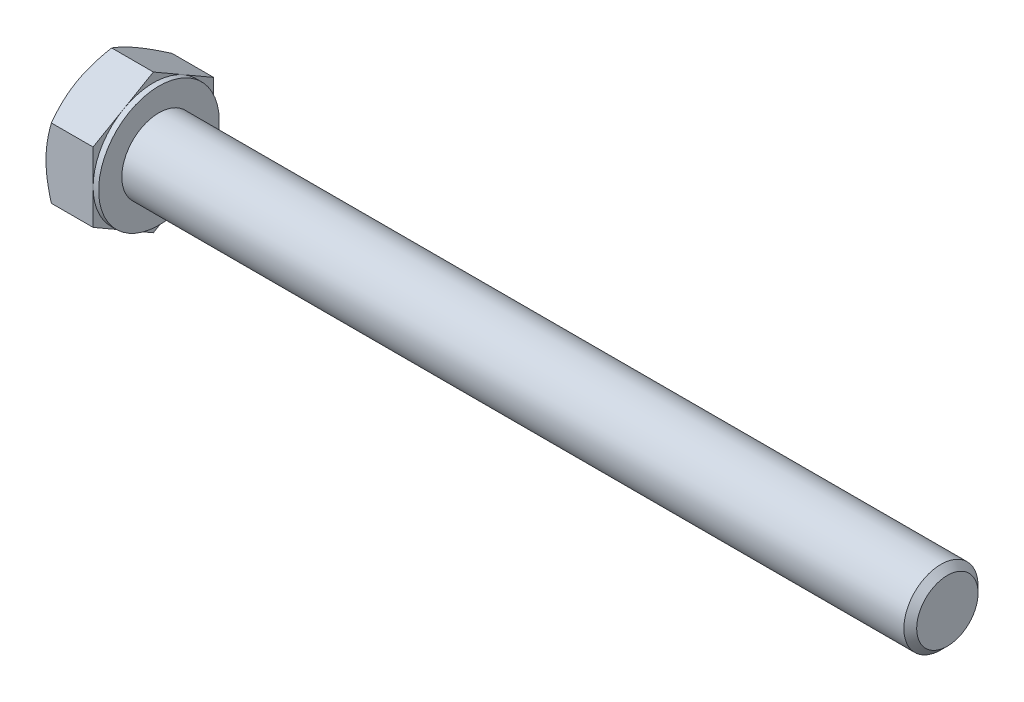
SolidWorks part; units mm, degrees
ref_plane "Plane1" through (0, 0, 0) normal (0, 0, 1) x (1, 0, 0)
ref_plane "Plane2" through (0, 0, 0) normal (0, 1, 0) x (1, 0, 0)
ref_plane "Plane3" through (0, 0, 0) normal (1, 0, 0) x (0, 0, -1)
extrude "BaseHead" add sketch "Sketch1" along normal blind 5.675
sketch "Sketch1" plane through (0, 0, 0) normal (1, 0, 0) x (0, 0, -1)
  line L0 (6.5, 3.7528) -> (6.5, -3.7528)
  line L1 (-6.5, 3.7528) -> (-6.5, -3.7528)
  line L2 (6.5, -3.7528) -> (0, -7.5056)
  line L3 (0, -7.5056) -> (-6.5, -3.7528)
  line L4 (6.5, 3.7528) -> (0, 7.5056)
  line L5 (0, 7.5056) -> (-6.5, 3.7528)
  dimension "Width_flats" = 13
  dimension "D2" = 120
  dimension "D3" = 6.5
  dimension "D4" = 6.5
  dimension "D5" = 6.5
revolve "BaseBody" add sketch "BodySke"
sketch "BodySke" plane through (0, 0, 0) normal (0, 0, 1) x (1, 0, 0)
  line L0 (0, 3.7528) -> (0, -3.7528) construction
  line L1 (0, 0) -> (90.675, 0)
  line L2 (0, 0) -> (0, 4)
  line L3 (0, 4) -> (89.9845, 4)
  line L4 (90.675, 0) -> (90.675, 3.3095)
  line L5 (5.675, 7.5056) -> (5.675, 3.7528) construction
  line L6 (90.675, 3.3095) -> (89.9845, 4)
  line L7 (0, 0) -> (96.52, 0) construction
  line L8 (90.675, -3.3095) -> (89.9845, -4) construction
  line L9 (0, -4) -> (89.9845, -4) construction
  line L10 (6.925, 15.24) -> (6.925, -1.27) construction
  line L11 (68.675, 15.24) -> (68.675, -1.27) construction
  line L12 (5.675, 3.7528) -> (5.675, -3.7528) construction
  dimension "Length" = 85
  dimension "Body_ch_ang" = 45
  dimension "Diameter" = 8
  dimension "Minor_dia" = 6.619
  dimension "Advance" = 1.25
  dimension "Thread_nom" = 22
fillet "HeadFillet" [suppressed] radius 0.4
sketch "Sketch3" plane through (0, 0, 0) normal (0, 0, 1) x (1, 0, 0)
  line L0 (0, 6.5) -> (3.4673, 12.5056)
  line L1 (0, 7.5056) -> (0, 3.7528) construction
  line L2 (3.4673, 12.5056) -> (3.4673, 17.5056)
  line L3 (3.4673, 17.5056) -> (-10, 17.5056)
  line L4 (-10, 17.5056) -> (-10, 6.5)
  line L5 (-10, 6.5) -> (0, 6.5)
  line L6 (0, 0) -> (99.06, 0) construction
  line L7 (5.675, 7.5056) -> (0, 7.5056) construction
  dimension "D1" = 6.5
  dimension "D2" = 5
  dimension "D3" = 10
  dimension "D4" = 5
  dimension "Head_ch_ang" = 30
revolve "HeadChamfer" cut sketch "Sketch3" angle 360 about L6
sketch "Sketch4" plane through (0, 0, 0) normal (0, 0, 1) x (1, 0, 0)
  line L1 (5.675, 7.5056) -> (5.675, 3.7528) construction
  line L2 (5.675, 6.5) -> (5.075, 6.5)
  line L3 (5.675, 6.5) -> (5.675, 17.5056)
  line L4 (5.675, 17.5056) -> (5.075, 17.5056)
  line L5 (0, 0) -> (95.25, 0) construction
  line L6 (0, 0) -> (96.52, 0) construction
  line L7 (5.075, 6.5) -> (5.075, 17.5056)
  line L8 (5.675, 7.5056) -> (0.5806, 7.5056) construction
  dimension "D1" = 13
  dimension "D2" = 10
  dimension "Bearing_ht" = 0.6
revolve "BearingFace" cut sketch "Sketch4" angle 360 about L5
sketch "ThdSchSke" plane through (0, 0, 0) normal (0, 0, 1) x (1, 0, 0)
  line L0 (68.675, -3.3095) -> (68.1915, -4)
  line L1 (68.675, -3.3095) -> (69.1585, -4)
  line L2 (69.1585, -4) -> (69.1585, -5)
  line L3 (-3.175, 0) -> (5.1513, 0) construction
  line L5 (69.1585, -5) -> (68.1915, -5)
  line L6 (68.1915, -5) -> (68.1915, -4)
  dimension "Thread_minor" = 6.619
  dimension "Diameter" = 8
  dimension "Start" = 68.675
  dimension "SideAngle" = 55
  dimension "VeeAngle" = 70
  dimension "Overcut" = 10
revolve "ThreadSchematic" [suppressed] cut sketch "ThdSchSke" angle 360 about L3
pattern_linear "ThdSchPat" [suppressed]
equation "\"D3@Sketch1\" = \"Width_flats@Sketch1\" / 2"
equation "\"D4@Sketch1\" = \"D3@Sketch1\""
equation "\"D5@Sketch1\" = \"D4@Sketch1\""
equation "\"Thread_minor@ThreadCosmetic\" = \"Minor_dia@BodySke\""
equation "\"D1@Sketch3\" = \"Width_flats@Sketch1\" / 2"
equation "\"D1@Sketch4\" = \"Width_flats@Sketch1\""
equation "\"Thread_length@ThreadCosmetic\" = ((sgn( (\"Length@BodySke\" - \"Advance@BodySke\" ) - \"Thread_nom@BodySke\" )-1)*( (\"Length@BodySke\" - \"Advance@BodySke\" ) - \"Thread_nom@BodySke\" ))/-2+ \"Thread_nom@BodySke\""
equation "\"Thread_minor@ThdSchSke\" = \"Minor_dia@BodySke\""
equation "\"Diameter@ThdSchSke\" = \"Diameter@BodySke\""
equation "\"Overcut@ThdSchSke\" = \"Diameter@BodySke\" * 1.25"
equation "\"Start@ThdSchSke\" = \"Head_ht@BaseHead\" + \"Length@BodySke\" - \"Thread_length@ThreadCosmetic\"  '---Non-countersunk---"
equation "\"Num_threads@ThdSchPat\" = int( \"Thread_length@ThreadCosmetic\" / \"Advance@BodySke\" + 0.999 )  + 1"
equation "\"Advance@ThdSchPat\" = \"Thread_length@ThreadCosmetic\" /  (\"Num_threads@ThdSchPat\" - 1) 'relax it"
equation "\"Num_threads@ThdSchPat\" = \"Num_threads@ThdSchPat\" - sgn( \"Num_threads@ThdSchPat\" - 1) '---chamfered tips only---"
